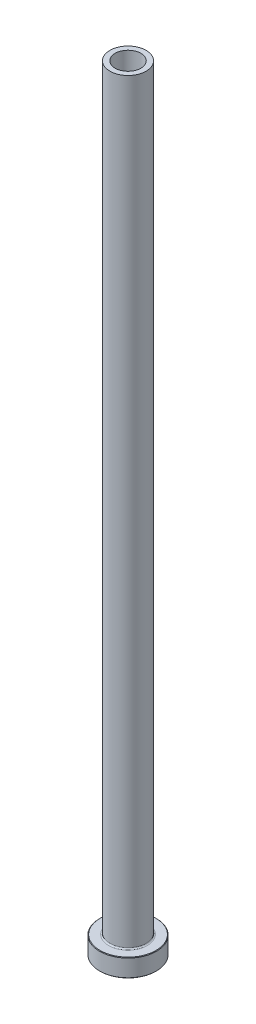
SolidWorks part; units mm, degrees
ref_plane "Front Plane" through (0, 0, 0) normal (0, 0, 1) x (1, 0, 0)
ref_plane "Top Plane" through (0, 0, 0) normal (0, 1, 0) x (1, 0, 0)
ref_plane "Right Plane" through (0, 0, 0) normal (1, 0, 0) x (0, 0, -1)
sketch "Sketch1" plane through (0, 0, 0) normal (0, 0, 1) x (1, 0, 0)
  line L0 (-5, 300) -> (-7, 300)
  line L1 (-7, 300) -> (-7, 7)
  line L2 (-7, 7) -> (-11, 7)
  line L3 (-11, 7) -> (-11, 0)
  line L4 (12.1, 0) -> (-12.1, 0) construction
  line L5 (-11, 0) -> (-5.25, 0)
  line L6 (-5, 255) -> (-5, 300)
  line L7 (0, 92.1877) -> (0, -15.5353) construction
  line L8 (0, -12.1) -> (0, 12.1) construction
  line L9 (-5, 255) -> (-5.25, 243)
  line L10 (-5.25, 243) -> (-5.25, 0)
  dimension "D1" = 0.25
  dimension "ID" = 10
  dimension "OD" = 14
  dimension "L" = 300
  dimension "H" = 22
  dimension "T" = 7
  dimension "N" = 45
  dimension "D2" = 12
revolve "Revolve1" add sketch "Sketch1" angle 360 about L7
fillet "Fillet1" radius 0.5 1 edges at (0, 7, 7)
chamfer "Chamfer1" distance 0.2 angle 45 2 edges at (0, 7, 11) (0, 0, 11)
chamfer "Chamfer3" distance 0.5 angle 45 1 edges at (0, 0, 5.25)
